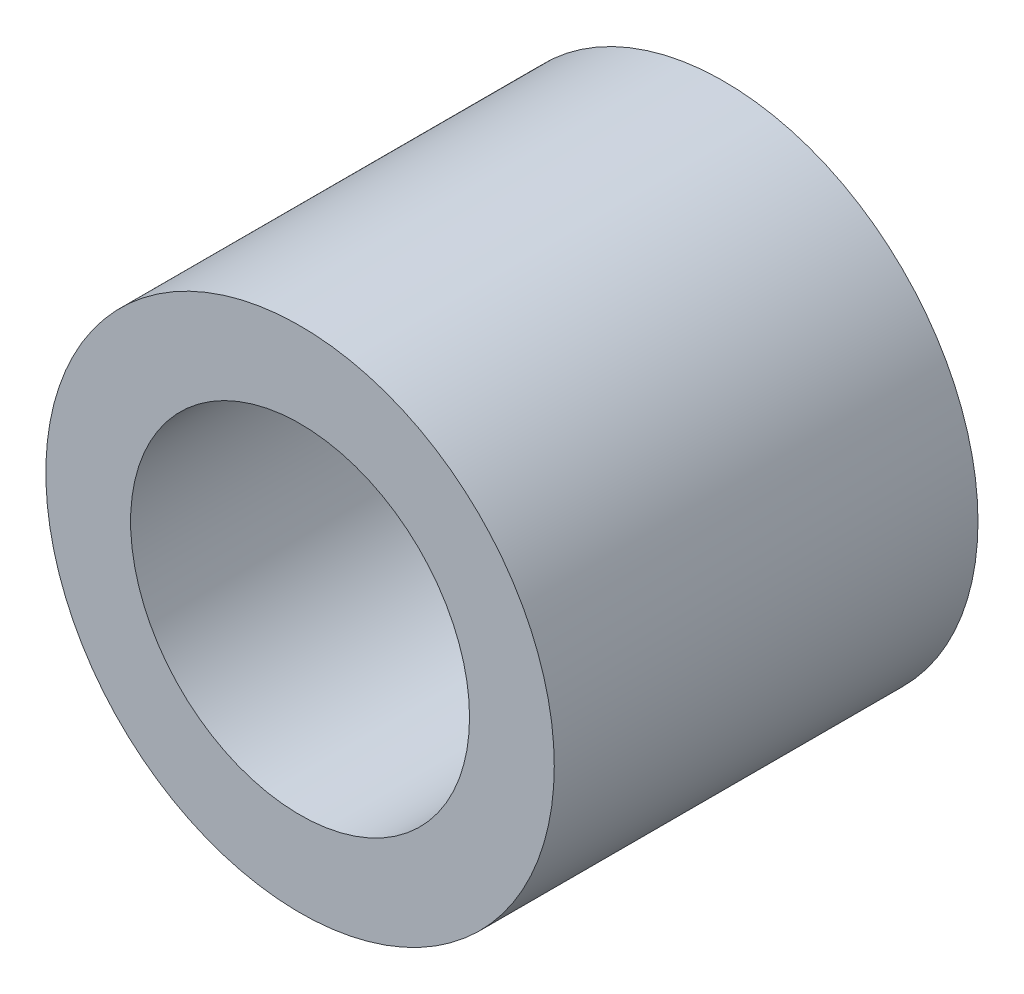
SolidWorks part; units mm, degrees
ref_plane "Ebene vorne" through (0, 0, 0) normal (0, 0, 1) x (1, 0, 0)
ref_plane "Ebene oben" through (0, 0, 0) normal (0, 1, 0) x (1, 0, 0)
ref_plane "Ebene rechts" through (0, 0, 0) normal (1, 0, 0) x (0, 0, -1)
sketch "Skizze1" plane through (0, 0, 0) normal (0, 0, 1) x (1, 0, 0)
  circle A0 centre (0, 0) radius 4
  circle A1 centre (0, 0) radius 6
  dimension "D1" = 8
  dimension "D2" = 12
extrude "Aufsatz-Linear austragen1" add sketch "Skizze1" along normal mid plane 10
